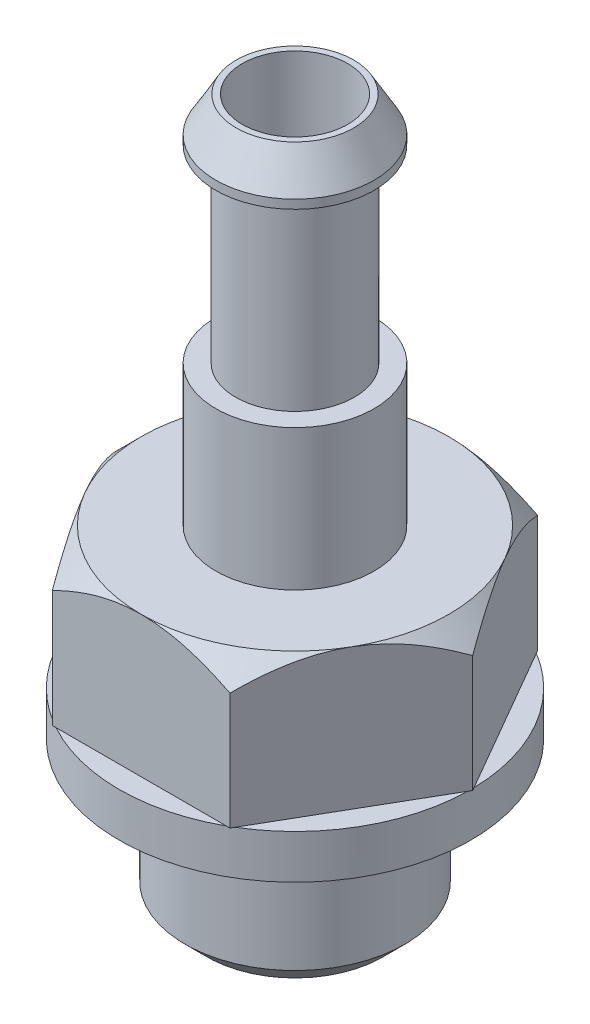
SolidWorks part; units mm, degrees
ref_plane "Vorne" through (0, 0, 0) normal (0, 0, 1) x (1, 0, 0)
ref_plane "Oben" through (0, 0, 0) normal (0, 1, 0) x (1, 0, 0)
ref_plane "Rechts" through (0, 0, 0) normal (1, 0, 0) x (0, 0, -1)
sketch "Skizze1" plane through (0, 0, 0) normal (0, 0, 1) x (1, 0, 0)
  line L0 (0, 0) -> (0, 16) construction
  line L1 (-1.2, 0) -> (-2, 0)
  line L2 (-2, 0) -> (-2.5, 0.5)
  line L3 (-2.5, 0.5) -> (-2.5, 3.3)
  line L4 (-4, 4.3) -> (-5, 4.3)
  line L5 (-5, 4.3) -> (-5, 6)
  line L6 (-3.5, 7.5) -> (-1.8, 7.5)
  line L7 (-1.8, 7.5) -> (-1.8, 10.7)
  line L8 (-1.8, 10.7) -> (-1.35, 10.7)
  line L9 (-1.35, 10.7) -> (-1.35, 15)
  line L10 (-1.35, 15) -> (-1.8, 15)
  line L11 (-1.8, 15) -> (-1.8, 15.2)
  line L12 (-4, 4.3) -> (-4, 3.3)
  line L13 (-4, 3.3) -> (-2.5, 3.3)
  line L14 (-1.2, 0) -> (-1.2, 16)
  line L15 (-1.8, 15.2) -> (-1.3381, 16)
  line L16 (-1.3381, 16) -> (-1.2, 16)
  line L17 (-5, 6) -> (-3.5, 7.5)
  point P7 (-5, 7.5)
  point P17 (-2.5, 0)
  dimension "D1" = 5
  dimension "D2" = 10
  dimension "D3" = 3.6
  dimension "D4" = 2.7
  dimension "D7" = 0.5
  dimension "D5" = 4.3
  dimension "D6" = 3.2
  dimension "D8" = 10.7
  dimension "D9" = 16
  dimension "D10" = 15
  dimension "D11" = 0.2
  dimension "D12" = 2.4
  dimension "D13" = 30
  dimension "D14" = 8
  dimension "D15" = 1
  dimension "D18" = 1.5
revolve "Rotation1" add sketch "Skizze1" angle 360 about L0
sketch "Skizze2" plane through (0, 4.3, 0) normal (0, -1, 0) x (1, 0, 0)
  line L1 (4.0415, 0) -> (2.0207, 3.5)
  line L2 (2.0207, 3.5) -> (-2.0207, 3.5)
  line L3 (-2.0207, 3.5) -> (-4.0415, 0)
  line L4 (-4.0415, 0) -> (-2.0207, -3.5)
  line L5 (-2.0207, -3.5) -> (2.0207, -3.5)
  line L6 (2.0207, -3.5) -> (4.0415, 0)
  circle A0 centre (0, 0) radius 3.5 construction
  circle A1 centre (0, 0) radius 5 construction
  circle A2 centre (0, 0) radius 5
extrude "Schnitt-Linear austragen1" cut sketch "Skizze2" against normal up to next
